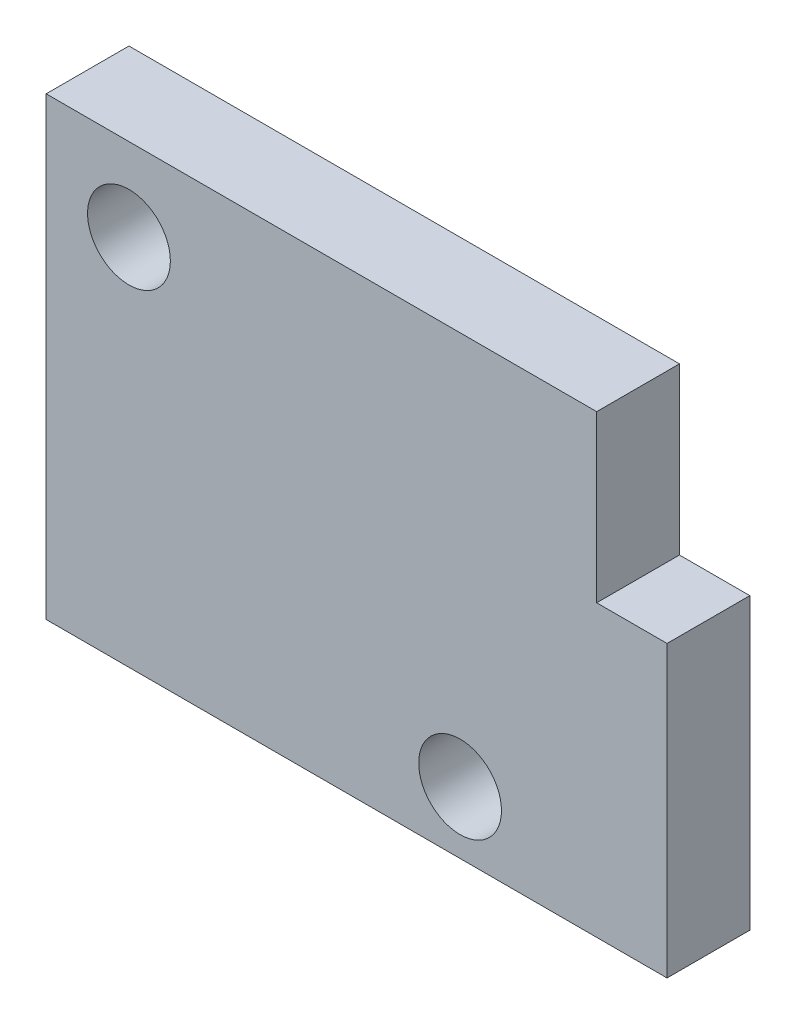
SolidWorks part; units mm, degrees
ref_plane "Front Plane" through (0, 0, 0) normal (0, 0, 1) x (1, 0, 0)
ref_plane "Top Plane" through (0, 0, 0) normal (0, 1, 0) x (1, 0, 0)
ref_plane "Right Plane" through (0, 0, 0) normal (1, 0, 0) x (0, 0, -1)
sketch "Sketch1" plane through (0, 0, 0) normal (0, 0, 1) x (1, 0, 0)
  line L0 (3.1517, 2.5654) -> (3.1517, 0.5654)
  line L1 (3.1517, 2.5654) -> (-3.4983, 2.5654)
  line L2 (4.0017, 0.5654) -> (4.0017, -2.9346)
  line L3 (4.0017, -2.9346) -> (-3.4983, -2.9346)
  line L4 (-3.4983, 2.5654) -> (-3.4983, -2.9346)
  line L6 (4.0017, -2.9346) -> (-3.4983, 2.5654) construction
  line L7 (3.1517, 0.5654) -> (4.0017, 0.5654)
  circle A0 centre (-2.4983, 1.5654) radius 0.5
  circle A1 centre (1.5017, -2.1846) radius 0.5
  point P0 (0, 0)
  dimension "D3" = 1
  dimension "D4" = 0.85
  dimension "D5" = 1
  dimension "D1" = 1
  dimension "D8" = 2.5
  dimension "D2" = 5.5
  dimension "D6" = 2
  dimension "D7" = 0.75
  dimension "D9" = 7.5
extrude "Boss-Extrude1" add sketch "Sketch1" along normal blind 1
